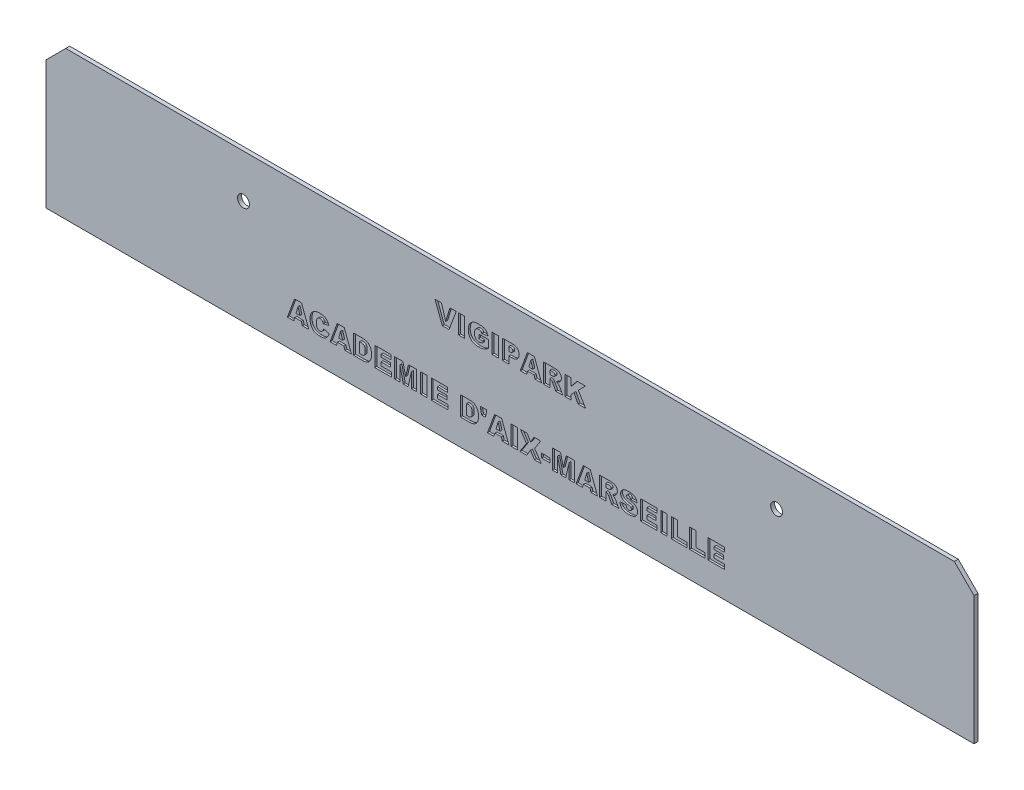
SolidWorks part; units mm, degrees
ref_plane "Face" through (0, 0, 0) normal (0, 0, 1) x (1, 0, 0)
ref_plane "Dessus" through (0, 0, 0) normal (0, 1, 0) x (1, 0, 0)
ref_plane "Droite" through (0, 0, 0) normal (1, 0, 0) x (0, 0, -1)
sketch "Esquisse1" plane through (0, 0, 0) normal (0, 0, 1) x (1, 0, 0)
  line L0 (-235, 65) -> (-225, 75)
  line L1 (-235, 0) -> (235, 0)
  line L2 (-235, 0) -> (-235, 65)
  line L3 (-225, 75) -> (225, 75)
  line L4 (235, 0) -> (235, 65)
  line L5 (225, 75) -> (235, 65)
  point P1 (235, 75)
  point P2 (-235, 75)
  dimension "D3" = 10
  dimension "D4" = 10
  dimension "D1" = 75
  dimension "D2" = 470
extrude "Plaque de base" add sketch "Esquisse1" along normal mid plane 2
sketch "Esquisse2" plane through (0, 0, 0) normal (0, 0, 1) x (1, 0, 0)
  line L0 (135, 53) -> (-135, 53) construction
  line L1 (0, 0) -> (0, 53) construction
  circle A0 centre (-135, 53) radius 3
  circle A1 centre (135, 53) radius 3
  dimension "D2" = 6
  dimension "D1" = 270
  dimension "D3" = 53
extrude "Trou rivets" cut sketch "Esquisse2" against normal through all and the other way through all
sketch "Esquisse3" plane through (0, 0, 1) normal (0, 0, 1) x (1, 0, 0)
  text T0 "<b>VIGIPARK</b>" font "Arial Black" height 10
  text T1 "<b>ACADEMIE D'AIX-MARSEILLE</b>" font "Arial Black" height 10
extrude "Teste" cut sketch "Esquisse3" against normal blind 1
